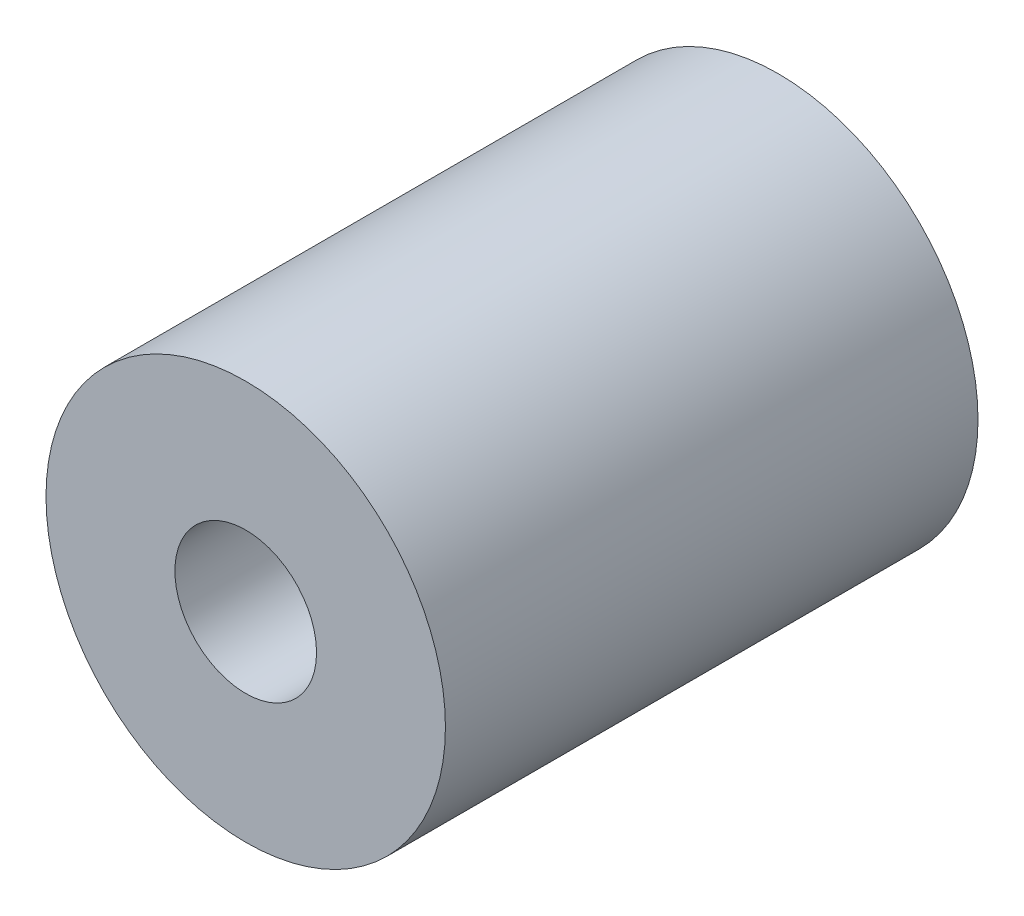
SolidWorks part; units mm, degrees
ref_plane "Front" through (0, 0, 0) normal (0, 0, 1) x (1, 0, 0)
ref_plane "Top" through (0, 0, 0) normal (0, 1, 0) x (1, 0, 0)
ref_plane "Right" through (0, 0, 0) normal (1, 0, 0) x (0, 0, -1)
sketch "Sketch1" plane through (0, 0, 0) normal (0, 0, 1) x (1, 0, 0)
  circle A0 centre (0, 0) radius 9.525
  circle A1 centre (0, 0) radius 3.3782
  dimension "D1" = 19.05
  dimension "D2" = 6.7564
extrude "Boss-Extrude1" add sketch "Sketch1" along normal mid plane 25.4
